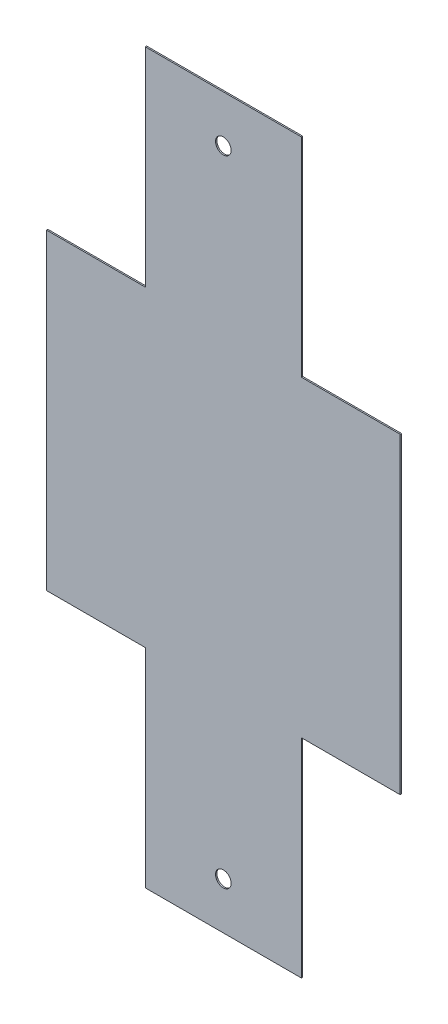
SolidWorks part; units mm, degrees
ref_plane "前基準面" through (0, 0, 0) normal (0, 0, 1) x (1, 0, 0)
ref_plane "上基準面" through (0, 0, 0) normal (0, 1, 0) x (1, 0, 0)
ref_plane "右基準面" through (0, 0, 0) normal (1, 0, 0) x (0, 0, -1)
sketch "草圖1" plane through (0, 0, 0) normal (0, 0, 1) x (1, 0, 0)
  line L1 (-38, 35) -> (38, 35)
  line L2 (-38, 35) -> (-38, -35)
  line L3 (-38, -35) -> (38, -35)
  line L4 (38, 35) -> (38, -35)
  line L5 (-38, 35) -> (38, -35) construction
  line L6 (-38, -35) -> (38, 35) construction
  point P0 (0, 0)
  dimension "D1" = 76
  dimension "D2" = 70
extrude "填料-伸長1" add sketch "草圖1" along normal blind 0.13
sketch "草圖2" plane through (0, 0, 0.13) normal (0, 0, 1) x (1, 0, 0)
  line L0 (0, 35) -> (0, -35) construction
  line L1 (-38, 35) -> (-7.5, 35)
  line L3 (-17, 15) -> (-7.5, 15)
  line L4 (-7.5, 35) -> (-7.5, 15)
  line L5 (38, 35) -> (-38, 35) construction
  line L6 (-38, -35) -> (38, -35) construction
  line L7 (-38, 0) -> (38, 0) construction
  line L8 (-38, 35) -> (-38, -35) construction
  line L9 (38, -35) -> (38, 35) construction
  line L10 (17, 15) -> (7.5, 15)
  line L11 (7.5, 35) -> (7.5, 15)
  line L12 (38, 35) -> (7.5, 35)
  line L15 (38, -35) -> (7.5, -35)
  line L16 (7.5, -35) -> (7.5, -15)
  line L17 (17, -15) -> (7.5, -15)
  line L18 (-17, -15) -> (-7.5, -15)
  line L19 (-7.5, -35) -> (-7.5, -15)
  line L20 (-38, -35) -> (-7.5, -35)
  line L22 (17, -15) -> (17, 15)
  line L23 (-17, -15) -> (-17, 15)
  line L26 (38, 35) -> (38, -35)
  line L27 (-38, 35) -> (-38, -35)
  dimension "D1" = 15
  dimension "D2" = 15
  dimension "D3" = 17
extrude "除料-伸長1" cut sketch "草圖2" against normal through all
sketch "草圖3" plane through (0, 0, 0.13) normal (0, 0, 1) x (1, 0, 0)
  line L0 (7.5, 35) -> (-7.5, 35) construction
  line L1 (-17, 0) -> (17, 0) construction
  line L2 (-17, -15) -> (-17, 15) construction
  line L3 (17, 15) -> (17, -15) construction
  circle A0 centre (0, 30.5) radius 0.75
  circle A1 centre (0, -30.5) radius 0.75
  dimension "D1" = 1.5
  dimension "D2" = 4.5
extrude "除料-伸長2" cut sketch "草圖3" against normal up to next
